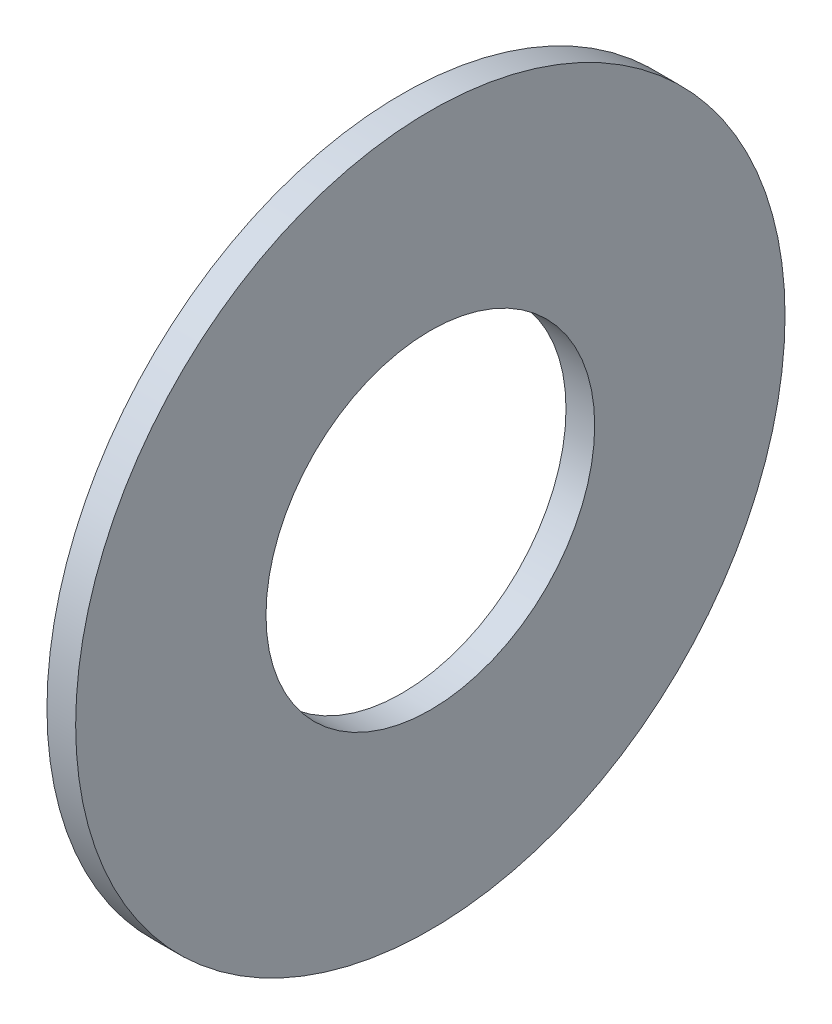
SolidWorks part; units mm, degrees
ref_plane "Plane1" through (0, 0, 0) normal (0, 0, 1) x (1, 0, 0)
ref_plane "Plane2" through (0, 0, 0) normal (0, 1, 0) x (1, 0, 0)
ref_plane "Plane3" through (0, 0, 0) normal (1, 0, 0) x (0, 0, -1)
other "Configuration Table"
sketch "Sketch1" plane through (0, 0, 0) normal (0, 0, 1) x (1, 0, 0)
  line L0 (-34.925, 0) -> (9.525, 0) construction
  line L1 (0, 26.1874) -> (0, 56.515)
  line L2 (0, 56.515) -> (-4.572, 56.515)
  line L3 (-4.572, 56.515) -> (-4.572, 26.1874)
  line L4 (-4.572, 26.1874) -> (0, 26.1874)
  dimension "Thickness" = 4.572
  dimension "Inside_dia" = 52.3748
  dimension "Outside_dia" = 113.03
revolve "Base-Revolve" add sketch "Sketch1" angle 360 about L0
